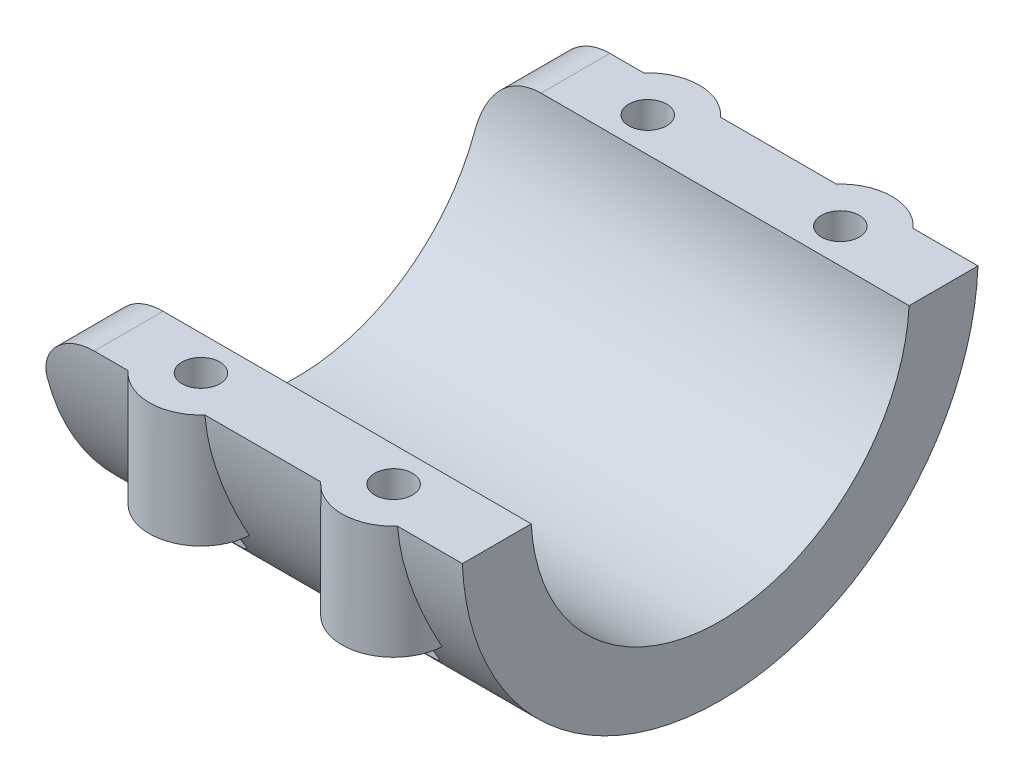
SolidWorks part; units mm, degrees
ref_plane "Face" through (0, 0, 0) normal (0, 0, 1) x (1, 0, 0)
ref_plane "Dessus" through (0, 0, 0) normal (0, 1, 0) x (1, 0, 0)
ref_plane "Droite" through (0, 0, 0) normal (1, 0, 0) x (0, 0, -1)
sketch "Esquisse1" plane through (0, 0, 0) normal (0, 0, 1) x (1, 0, 0)
  line L0 (0, 0) -> (130.2531, 0) construction
  line L1 (0, 16.5) -> (0, 2.5)
  line L2 (18, 17.5) -> (4, 17.5)
  line L3 (18, 23.9708) -> (18, 17.5)
  line L4 (26, 31.9708) -> (26, 37.5)
  line L5 (26, 37.5) -> (100, 37.5)
  line L6 (100, 37.5) -> (100, 27.5)
  line L7 (100, 27.5) -> (36, 27.5)
  line L8 (36, 27.5) -> (36, 2.5)
  line L9 (2, 17.5) -> (2, 16)
  line L10 (2, 16) -> (4, 16)
  line L11 (4, 16) -> (4, 17.5)
  line L12 (2, 17.5) -> (1, 17.5)
  line L13 (1, 17.5) -> (0, 16.5)
  line L14 (36, 2.5) -> (0, 2.5)
  arc A0 (18, 23.9708) -> (26, 31.9708) centre (18, 31.9708) ccw
  dimension "D3" = 8
  dimension "D1" = 35
  dimension "D2" = 18
  dimension "D4" = 75
  dimension "D5" = 55
  dimension "D6" = 8
  dimension "D7" = 74
  dimension "D8" = 14
  dimension "D9" = 2
  dimension "D10" = 45
  dimension "D11" = 32
  dimension "D12" = 10
  dimension "D13" = 5
revolve "Révolution1" add sketch "Esquisse1" angle 360 about L0
sketch "Esquisse2" plane through (0, 0, 0) normal (0, 0, 1) x (1, 0, 0)
  line L0 (36, 40.8684) -> (36, 8.5)
  line L1 (46, -1.5) -> (100, -1.5)
  line L2 (100, -37.5) -> (100, 37.5) construction
  line L3 (26, 37.5) -> (26, -37.5) construction
  line L4 (36, 40.8684) -> (100, 40.8684)
  line L6 (26, -37.5) -> (100, -37.5) construction
  line L9 (100, 40.8684) -> (100, -1.5)
  arc A0 (36, 8.5) -> (46, -1.5) centre (46, 8.5) ccw
  dimension "D3" = 10
  dimension "D1" = 10
  dimension "D2" = 36
extrude "Enlèv. mat.-Extru.1" cut sketch "Esquisse2" against normal through all and the other way through all
sketch "Esquisse3" plane through (0, -1.5, 0) normal (0, 1, 0) x (-1, 0, 0)
  line L0 (-100, 32.4645) -> (-66.2059, 32.4645) construction
  line L1 (-100, 27.4591) -> (-100, 37.47) construction
  line L2 (-91.7004, 29.0948) -> (-78.2996, 29.0948)
  line L3 (-63.7004, 29.0948) -> (-50.2996, 29.0948)
  line L4 (-47.2008, 0) -> (-85, 0) construction
  line L5 (-63.7004, -29.0948) -> (-50.2996, -29.0948)
  line L6 (-91.7004, -29.0948) -> (-78.2996, -29.0948)
  arc A0 (-78.2996, 29.0948) -> (-91.7004, 29.0948) centre (-85, 32.4645) ccw
  arc A1 (-50.2996, 29.0948) -> (-63.7004, 29.0948) centre (-57, 32.4645) ccw
  arc A2 (-50.2996, -29.0948) -> (-63.7004, -29.0948) centre (-57, -32.4645) cw
  arc A3 (-78.2996, -29.0948) -> (-91.7004, -29.0948) centre (-85, -32.4645) cw
  dimension "D1" = 15
  dimension "D2" = 15
extrude "Extrusion1" add sketch "Esquisse3" against normal blind 16.5
sketch "Esquisse4" plane through (0, -18, 0) normal (0, -1, 0) x (1, 0, 0)
  line L13 (0, 0) -> (36.4459, 0) construction
  circle A0 centre (85, 32.4645) radius 4.5
  circle A1 centre (57, -32.4645) radius 4.5
  circle A2 centre (85, -32.4645) radius 4.5
  circle A4 centre (57, 32.4645) radius 4.5
  dimension "D1" = 9
extrude "Enlèv. mat.-Extru.2" cut sketch "Esquisse4" against normal blind 6 and the other way through all draft 2
sketch "Esquisse5" plane through (0, -1.5, 0) normal (0, 1, 0) x (-1, 0, 0)
  line L0 (0, 0) -> (-45.8187, 0) construction
  circle A0 centre (-85, -32.4645) radius 2.75
  circle A1 centre (-57, -32.4645) radius 2.75
  circle A2 centre (-57, 32.4645) radius 2.75
  circle A3 centre (-85, 32.4645) radius 2.75
  dimension "D1" = 5.5
extrude "Enlèv. mat.-Extru.3" cut sketch "Esquisse5" against normal through all
sketch "Esquisse7" plane through (0, 0, 0) normal (0, 0, 1) x (1, 0, 0)
  line L0 (38.5, -42.9949) -> (38.5, -9.5)
  line L1 (51.4147, -1.5) -> (46, -1.5) construction
  line L2 (103.5139, -1.5) -> (46.5, -1.5)
  line L3 (36, 8.5) -> (36, 37.5) construction
  line L4 (38.5, -42.9949) -> (-8.4601, -42.9949)
  line L5 (-8.4601, -42.9949) -> (-8.4601, 48.9571)
  line L6 (-8.4601, 48.9571) -> (103.5139, 48.9571)
  line L7 (103.5139, 48.9571) -> (103.5139, -1.5)
  arc A0 (38.5, -9.5) -> (46.5, -1.5) centre (46.5, -9.5) cw
  dimension "D2" = 8
  dimension "D1" = 2.5
extrude "Enlèv. mat.-Extru.5" cut sketch "Esquisse7" against normal through all and the other way through all
